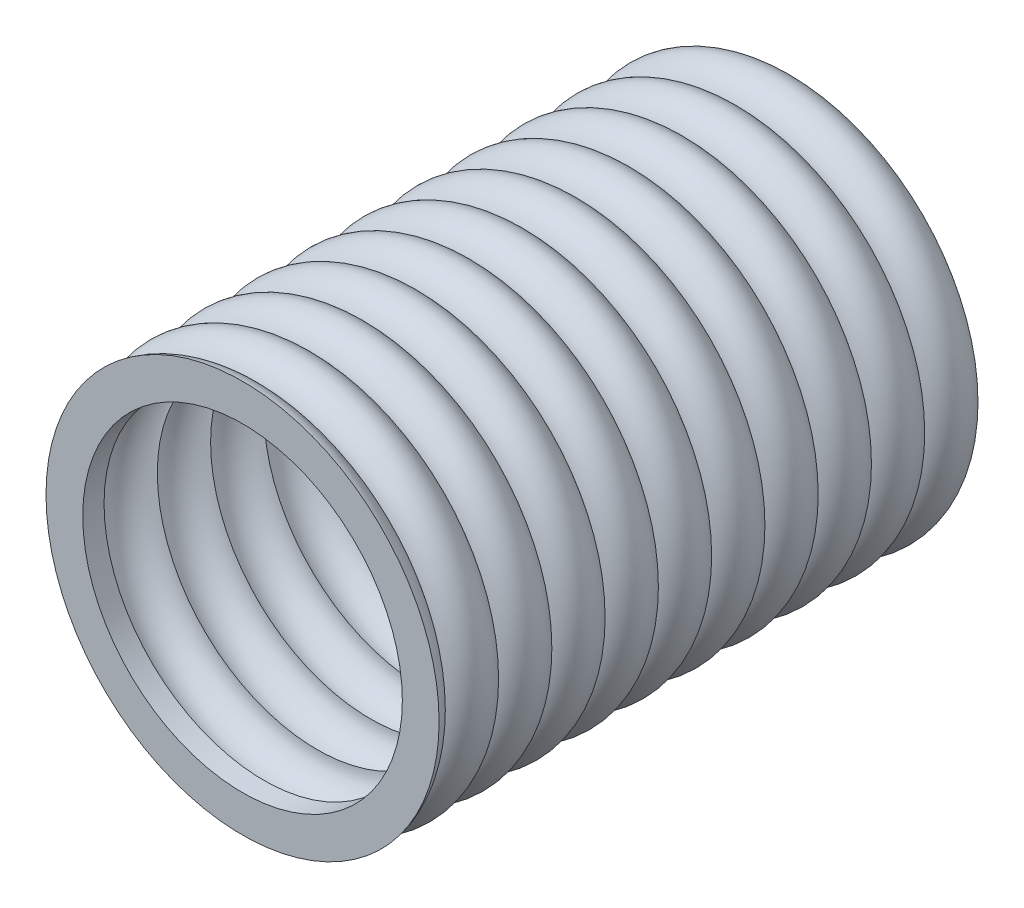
SolidWorks part; units mm, degrees
ref_plane "Front Plane" through (0, 0, 0) normal (0, 0, 1) x (1, 0, 0)
ref_plane "Top Plane" through (0, 0, 0) normal (0, 1, 0) x (1, 0, 0)
ref_plane "Right Plane" through (0, 0, 0) normal (1, 0, 0) x (0, 0, -1)
sketch "Sketch1" plane through (0, 0, 0) normal (0, 0, 1) x (1, 0, 0)
  line L0 (0, 76.5931) -> (0, -86.61) construction
  line L1 (-82.3345, 0) -> (103.59, 0) construction
  circle A0 centre (0, 0) radius 9.525
  circle A1 centre (0, 0) radius 11.7475
  dimension "D1" = 23.495
  dimension "D2" = 19.05
extrude "Boss-Extrude1" add sketch "Sketch1" along normal blind 33.02
sketch "Sketch2" plane through (0, 0, 0) normal (0, 1, 0) x (1, 0, 0)
  line L0 (11.7475, 0) -> (-11.7475, 0) construction
  line L1 (11.7475, -33.02) -> (11.7475, 0) construction
  line L2 (0, 1.8698) -> (0, -32.5819) construction
  line L3 (10.16, 0) -> (12.7, 0)
  line L5 (10.16, -3.175) -> (12.7, -3.175)
  line L6 (12.7, 0) -> (12.7, -3.175)
  arc A0 (10.16, -3.175) -> (10.16, 0) centre (10.16, -1.5875) ccw
  dimension "D2" = 3.175
  dimension "D1" = 1.5875
  dimension "D3" = 2.54
  dimension "D4" = 3.175
revolve "Cut-Revolve2" cut sketch "Sketch2" angle 360 about L2
pattern_linear "LPattern2" count 11 spacing 3.175 along (0, 0, 1) of "Cut-Revolve2"
sketch "Sketch4" plane through (0, 0, 0) normal (0, 1, 0) x (1, 0, 0)
  line L1 (9.525, -3.175) -> (6.35, -3.175)
  line L2 (10.16, 0) -> (-10.16, 0) construction
  line L3 (9.525, 0) -> (6.35, 0)
  line L4 (6.35, -3.175) -> (6.35, 0)
  arc A0 (9.525, -3.175) -> (9.525, 0) centre (9.525, -1.5875) ccw
  arc A1 (10.16, -3.175) -> (10.16, 0) centre (10.16, -1.5875) ccw construction
  dimension "D1" = 3.175
  dimension "D5" = 0.635
  dimension "D2" = 1.5875
  dimension "D3" = 3.175
  dimension "D4" = 3.175
revolve "Cut-Revolve3" cut sketch "Sketch4" angle 360 about L2
pattern_linear "LPattern3" count 10 spacing 3.175 along (0, 0, 1) of "Cut-Revolve3"
sketch "Sketch6" [suppressed] plane through (0, 0, 0) normal (0, 1, 0) x (1, 0, 0)
  line L0 (-11.43, -17.145) -> (-12.3825, -15.24)
  line L2 (-11.43, -17.145) -> (-11.43, -21.59)
  line L3 (-11.43, -21.59) -> (-14.605, -21.59)
  line L4 (-14.605, -17.145) -> (-14.605, -21.59)
  line L5 (-12.3825, -15.24) -> (-12.3825, -19.05)
  line L6 (-12.3825, -19.05) -> (-13.6525, -19.05)
  line L7 (-13.6525, -19.05) -> (-13.6525, -15.24)
  line L8 (-14.605, -17.145) -> (-13.6525, -15.24)
  line L9 (-13.0175, -15.3829) -> (-13.0175, -21.9451) construction
  dimension "D1" = 1.27
  dimension "D2" = 3.81
  dimension "D3" = 3.175
  dimension "D4" = 1.905
  dimension "D5" = 6.35
revolve "Revolve1" [suppressed] add sketch "Sketch6" angle 360 about L2
